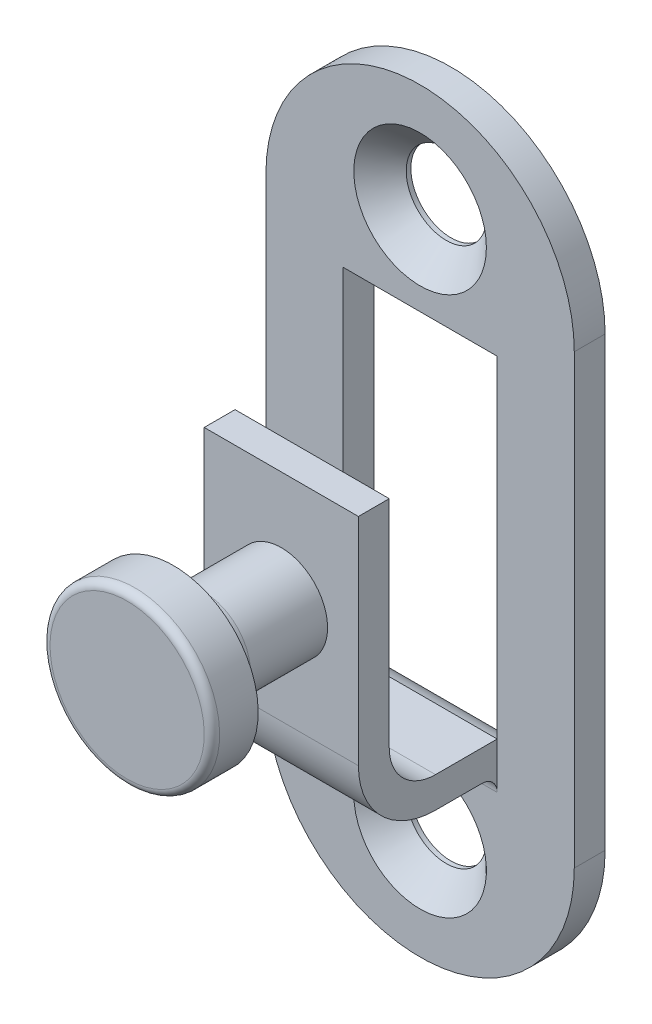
SolidWorks part; units mm, degrees
ref_plane "正面" through (0, 0, 0) normal (0, 0, 1) x (1, 0, 0)
ref_plane "平面" through (0, 0, 0) normal (0, 1, 0) x (1, 0, 0)
ref_plane "右側面" through (0, 0, 0) normal (1, 0, 0) x (0, 0, -1)
ref_plane "平面1" through (0, 0, 0) normal (0, 0, 1) x (1, 0, 0)
sketch "ｽｹｯﾁ1" plane through (0, 0, 0) normal (0, 0, 1) x (1, 0, 0)
  line L0 (10, -14.5) -> (10, 14.5)
  line L1 (-10, 14.5) -> (-10, -14.5)
  line L2 (-5, 11.75) -> (-5, -11.75)
  line L3 (-5, -11.75) -> (5, -11.75)
  line L4 (5, -11.75) -> (5, 11.75)
  line L5 (5, 11.75) -> (-5, 11.75)
  arc A0 (-10, -14.5) -> (10, -14.5) centre (0, -14.5) ccw
  arc A1 (10, 14.5) -> (-10, 14.5) centre (0, 14.5) ccw
extrude "押し出し1" add sketch "ｽｹｯﾁ1" along normal blind 2
ref_plane "平面2" through (0, 0, 0) normal (1, 0, 0) x (0, 0, -1)
ref_plane "平面3" through (0, 0, 0) normal (1, 0, 0) x (0, 0, -1)
ref_plane "平面4" through (0, 0, 0) normal (1, 0, 0) x (0, 0, -1)
sketch "ｽｹｯﾁ4" plane through (0, 0, 0) normal (1, 0, 0) x (0, 0, -1)
  line L0 (-11, 7.25) -> (-11, -6.75)
  line L1 (-6, -11.75) -> (-3, -11.75)
  line L2 (-2, -12.75) -> (-2, -13.75)
  line L3 (-2, -13.75) -> (0, -13.75)
  line L4 (0, -13.75) -> (0, -11.75)
  line L5 (-2, -9.75) -> (-6, -9.75)
  line L6 (-9, -6.75) -> (-9, 7.25)
  line L7 (-9, 7.25) -> (-11, 7.25)
  arc A0 (-11, -6.75) -> (-6, -11.75) centre (-6, -6.75) ccw
  arc A1 (-3, -11.75) -> (-2, -12.75) centre (-3, -12.75) cw
  arc A2 (0, -11.75) -> (-2, -9.75) centre (-2.8708, -12.6208) ccw
  arc A3 (-6, -9.75) -> (-9, -6.75) centre (-6, -6.75) cw
extrude "押し出し2" add sketch "ｽｹｯﾁ4" against normal blind 5 and the other way blind 5
sketch "ｽｹｯﾁ2" plane through (0, 0, 0) normal (1, 0, 0) x (0, 0, -1)
  line L0 (-2, 17.5) -> (-2, 21.8)
  line L1 (-2, 21.8) -> (-0.3, 20.1)
  line L2 (-0.3, 20.1) -> (0, 20.1)
  line L3 (0, 20.1) -> (0, 17.5)
  line L4 (0, 17.5) -> (-2, 17.5)
  line L5 (0, 17.5) -> (-2, 17.5) construction
  dimension "D1" = 4.3
  dimension "D2" = 2.6
  dimension "D3" = 45
revolve "ｶｯﾄ - 回転1" cut sketch "ｽｹｯﾁ2" angle 360 about L5
sketch "ｽｹｯﾁ3" plane through (0, 0, 0) normal (1, 0, 0) x (0, 0, -1)
  line L0 (0, -17.5) -> (0, -20.1)
  line L1 (0, -20.1) -> (-0.3, -20.1)
  line L2 (-0.3, -20.1) -> (-2, -21.8)
  line L3 (-2, -21.8) -> (-2, -17.5)
  line L4 (-2, -17.5) -> (0, -17.5)
  line L5 (-2, -17.5) -> (0, -17.5) construction
  dimension "D1" = 2.6
  dimension "D2" = 4.3
  dimension "D3" = 45
revolve "ｶｯﾄ - 回転2" cut sketch "ｽｹｯﾁ3" angle 360 about L5
ref_plane "平面5" through (0, 0, 0) normal (1, 0, 0) x (0, 0, -1)
sketch "ｽｹｯﾁ5" plane through (0, 0, 0) normal (1, 0, 0) x (0, 0, -1)
  line L0 (-11, 0) -> (-11, 3)
  line L1 (-11, 3) -> (-10.4585, 2.4585)
  line L2 (-10.4585, 2.4585) -> (-9.5415, 2.4585)
  line L3 (-9.5415, 2.4585) -> (-9, 3)
  line L4 (-9, 3) -> (-9, 0)
  line L5 (-9, 0) -> (-11, 0)
  line L6 (-9, 0) -> (-11, 0) construction
revolve "ｶｯﾄ - 回転3" cut sketch "ｽｹｯﾁ5" angle 360 about L6
ref_plane "平面6" through (0, 0, 0) normal (1, 0, 0) x (0, 0, -1)
sketch "ｽｹｯﾁ6" plane through (0, 0, 0) normal (1, 0, 0) x (0, 0, -1)
  line L0 (-21, 0) -> (-21, 5)
  line L1 (-20.5, 5.5) -> (-18, 5.5)
  line L2 (-18, 5.5) -> (-18, 3.2)
  line L3 (-18, 3.2) -> (-16, 3)
  line L4 (-16, 3) -> (-9.6135, 3)
  line L5 (-9.6135, 3) -> (-9, 2.3865)
  line L6 (-9, 2.3865) -> (-9, 0)
  line L7 (-9, 0) -> (-21, 0)
  line L8 (-9, 0) -> (-21, 0) construction
  arc A0 (-21, 5) -> (-20.5, 5.5) centre (-20.5, 5) cw
revolve "回転1" add sketch "ｽｹｯﾁ6" angle 360 about L8
